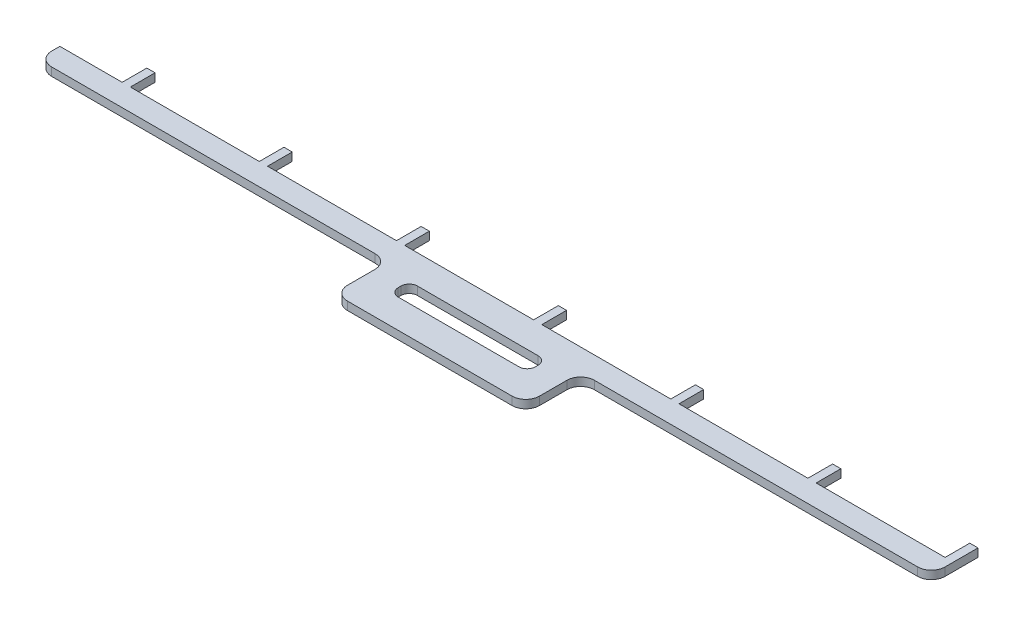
SolidWorks part; units mm, degrees
ref_plane "Plan de face" through (0, 0, 0) normal (0, 0, 1) x (1, 0, 0)
ref_plane "Plan de dessus" through (0, 0, 0) normal (0, 1, 0) x (1, 0, 0)
ref_plane "Plan de droite" through (0, 0, 0) normal (1, 0, 0) x (0, 0, -1)
sketch "Esquisse1" plane through (0, -134, 0) normal (0, 1, 0) x (1, 0, 0)
  line L1 (-153, -2.9) -> (-123.5, -2.9) construction
  line L2 (-150, -2.9) -> (-150, 6.1)
  line L3 (-153, 6.1) -> (-123.5, 6.1) construction
  line L4 (-150, 6.1) -> (-153, 6.1)
  line L5 (-153, 6.1) -> (-153, -2.9)
  line L6 (-153, -2.9) -> (-175.7, -2.9)
  line L7 (-175.7, -2.9) -> (-175.7, -5.9)
  line L8 (-170.7, -10.9) -> (-52.85, -10.9)
  line L9 (-103, 6.1) -> (-103, -2.9)
  line L10 (-100, -2.9) -> (-100, 6.1)
  line L11 (-100, 6.1) -> (-103, 6.1)
  line L12 (-53, 6.1) -> (-53, -2.9)
  line L13 (-50, -2.9) -> (-50, 6.1)
  line L14 (-50, 6.1) -> (-53, 6.1)
  line L15 (-3, 6.1) -> (-3, -2.9)
  line L16 (0, -2.9) -> (0, 6.1)
  line L17 (0, 6.1) -> (-3, 6.1)
  line L18 (47, 6.1) -> (47, -2.9)
  line L19 (50, -2.9) -> (50, 6.1)
  line L20 (50, 6.1) -> (47, 6.1)
  line L21 (97, 6.1) -> (97, -2.9)
  line L22 (100, -2.9) -> (100, 6.1)
  line L23 (100, 6.1) -> (97, 6.1)
  line L24 (147, 6.1) -> (147, -2.9)
  line L25 (150, -2.9) -> (150, 6.1)
  line L26 (150, 6.1) -> (147, 6.1)
  line L27 (150, -2.9) -> (150, -5.9)
  line L28 (147, -2.9) -> (100, -2.9)
  line L29 (97, -2.9) -> (50, -2.9)
  line L30 (47, -2.9) -> (0, -2.9)
  line L31 (-3, -2.9) -> (-50, -2.9)
  line L32 (-53, -2.9) -> (-100, -2.9)
  line L33 (-103, -2.9) -> (-150, -2.9)
  line L34 (27.15, -10.9) -> (145, -10.9)
  line L36 (-47.85, -15.9) -> (-47.85, -25.9)
  line L37 (-42.85, -30.9) -> (17.15, -30.9)
  line L38 (22.15, -15.9) -> (22.15, -25.9)
  line L39 (-12.85, -30.9) -> (-12.85, -2.9) construction
  line L40 (-34.85, -13.4) -> (9.15, -13.4)
  line L41 (-37.85, -16.4) -> (-37.85, -17.4)
  line L42 (-34.85, -20.4) -> (9.15, -20.4)
  line L43 (12.15, -16.4) -> (12.15, -17.4)
  line L44 (-47.85, -16.9) -> (22.15, -16.9) construction
  arc A0 (145, -10.9) -> (150, -5.9) centre (145, -5.9) ccw
  arc A1 (-175.7, -5.9) -> (-170.7, -10.9) centre (-170.7, -5.9) ccw
  arc A2 (17.15, -30.9) -> (22.15, -25.9) centre (17.15, -25.9) ccw
  arc A3 (-47.85, -25.9) -> (-42.85, -30.9) centre (-42.85, -25.9) ccw
  arc A4 (27.15, -10.9) -> (22.15, -15.9) centre (27.15, -15.9) ccw
  arc A5 (-52.85, -10.9) -> (-47.85, -15.9) centre (-52.85, -15.9) cw
  arc A6 (9.15, -13.4) -> (12.15, -16.4) centre (9.15, -16.4) cw
  arc A7 (9.15, -20.4) -> (12.15, -17.4) centre (9.15, -17.4) ccw
  arc A8 (-37.85, -17.4) -> (-34.85, -20.4) centre (-34.85, -17.4) ccw
  arc A9 (-34.85, -13.4) -> (-37.85, -16.4) centre (-34.85, -16.4) ccw
  point P45 (-175.7, -10.9)
  point P55 (-12.85, -16.9)
  point P60 (22.15, -30.9)
  point P65 (-47.85, -30.9)
  point P68 (22.15, -10.9)
  point P77 (-37.85, -20.4)
  point P80 (-37.85, -13.4)
  dimension "D4" = 5
  dimension "D9" = 5
  dimension "D10" = 3
  dimension "D1" = 3
  dimension "D2" = 7
  dimension "D3" = 8
  dimension "D5" = 70
  dimension "D6" = 20
  dimension "D7" = 7
  dimension "D8" = 10
extrude "Boss.-Extru.1" add sketch "Esquisse1" along normal up to vertex (3 mm away)
